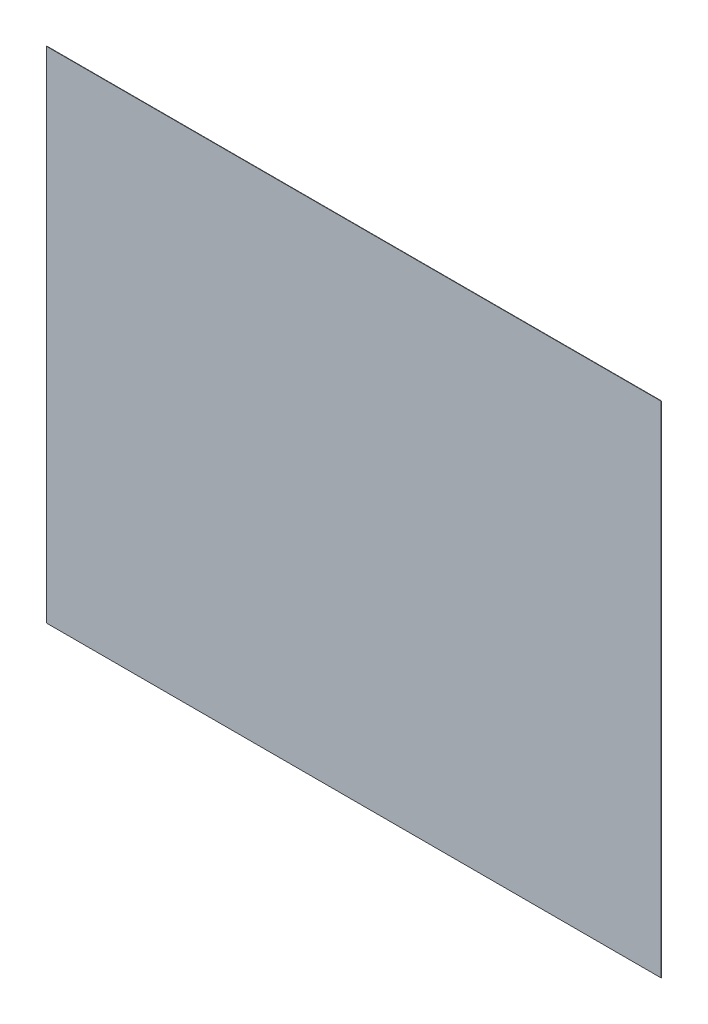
SolidWorks part; units mm, degrees
ref_plane "Piano frontale" through (0, 0, 0) normal (0, 0, 1) x (1, 0, 0)
ref_plane "Piano superiore" through (0, 0, 0) normal (0, 1, 0) x (1, 0, 0)
ref_plane "Piano destro" through (0, 0, 0) normal (1, 0, 0) x (0, 0, -1)
sketch "Schizzo1" plane through (0, 0, 0) normal (0, 0, 1) x (1, 0, 0)
  line L1 (-800, -650) -> (800, -650)
  line L2 (-800, -650) -> (-800, 650)
  line L3 (-800, 650) -> (800, 650)
  line L4 (800, -650) -> (800, 650)
  line L5 (-800, -650) -> (800, 650) construction
  line L6 (-800, 650) -> (800, -650) construction
  point P0 (0, 0)
  dimension "D1" = 1600
  dimension "D2" = 1300
extrude "Estrusione-Estrusione1" add sketch "Schizzo1" along normal blind 1
